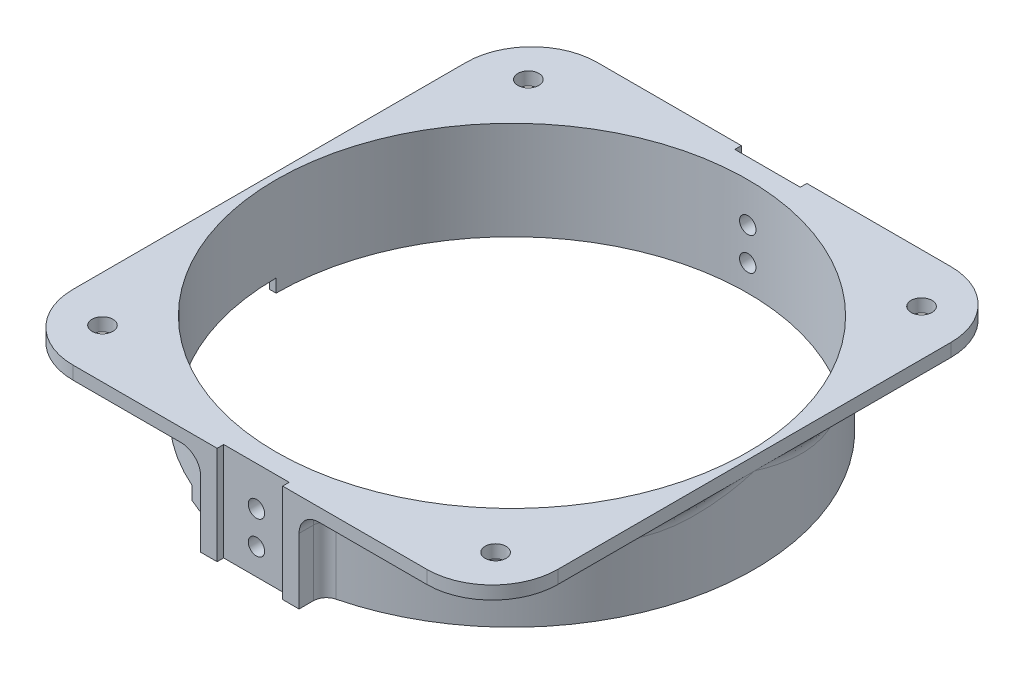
SolidWorks part; units mm, degrees
ref_plane "前视基准面" through (0, 0, 0) normal (0, 0, 1) x (1, 0, 0)
ref_plane "上视基准面" through (0, 0, 0) normal (0, 1, 0) x (1, 0, 0)
ref_plane "右视基准面" through (0, 0, 0) normal (1, 0, 0) x (0, 0, -1)
sketch "草图1" plane through (0, 0, 0) normal (0, 1, 0) x (1, 0, 0)
  circle A0 centre (0, 0) radius 36
  circle A1 centre (0, 0) radius 37
  dimension "D1" = 72
  dimension "D2" = 74
extrude "凸台-拉伸1" add sketch "草图1" along normal blind 15
sketch "草图2" plane through (0, 0, 0) normal (0, 1, 0) x (1, 0, 0)
  line L0 (-74.8137, 0) -> (0, 0) construction
  line L1 (0, 0) -> (0, -90.7206) construction
  line L3 (-37, 0) -> (-15, 0)
  line L4 (-37, 0) -> (-37, -40.3453)
  line L5 (-37, -40.3453) -> (-15, -40.3453)
  line L6 (-15, 0) -> (-15, -40.3453)
  circle A0 centre (0, 0) radius 37 construction
  dimension "D1" = 22
extrude "切除-拉伸1" cut sketch "草图2" along normal blind 2
sketch "草图3" plane through (0, 15, 0) normal (0, 1, 0) x (1, 0, 0)
  line L0 (0, -75.1314) -> (0, 57.0329) construction
  line L1 (57.2671, 0) -> (-67.0606, 0) construction
  line L2 (7.5, 40) -> (-7.5, 36.2319) construction
  line L3 (7.5, -40) -> (-7.5, -40)
  line L4 (7.5, -40) -> (7.5, -36.2319)
  line L5 (7.5, -36.2319) -> (-7.5, -36.2319)
  line L6 (-7.5, -40) -> (-7.5, -36.2319)
  line L7 (7.5, -40) -> (-7.5, -36.2319) construction
  line L8 (7.5, -36.2319) -> (-7.5, -40) construction
  line L9 (7.5, 40) -> (7.5, 36.2319)
  line L10 (7.5, 40) -> (-7.5, 40)
  line L11 (7.5, 36.2319) -> (-7.5, 40) construction
  line L12 (-7.5, 40) -> (-7.5, 36.2319)
  line L13 (7.5, 36.2319) -> (-7.5, 36.2319)
  circle A0 centre (0, 0) radius 37 construction
  point P5 (0, -38.1159)
  point P17 (0, 38.1159)
  dimension "D1" = 80
  dimension "D2" = 15
extrude "凸台-拉伸2" add sketch "草图3" against normal up to surface (15 mm away)
sketch "草图4" plane through (0, 15, 0) normal (0, 1, 0) x (1, 0, 0)
  line L0 (0, -71.6557) -> (0, 76.2439) construction
  line L1 (77.9233, 0) -> (-76.0365, 0) construction
  line L2 (7.5, 40) -> (-7.5, 40) construction
  line L3 (5, 39) -> (-5, 39)
  line L4 (5, 39) -> (5, 40)
  line L5 (5, 40) -> (-5, 40)
  line L6 (-5, 39) -> (-5, 40)
  line L7 (5, 39) -> (-5, 40) construction
  line L8 (5, 40) -> (-5, 39) construction
  line L9 (5, -40) -> (-5, -39) construction
  line L10 (5, -39) -> (-5, -40) construction
  line L11 (-5, -39) -> (-5, -40)
  line L12 (5, -40) -> (-5, -40)
  line L13 (5, -39) -> (5, -40)
  line L14 (5, -39) -> (-5, -39)
  point P5 (0, 39.5)
  point P16 (0, -39.5)
  dimension "D1" = 1
  dimension "D2" = 10
extrude "切除-拉伸2" cut sketch "草图4" against normal through all
fillet "圆角1" radius 2 4 edges at (-7.5, 7.5, 36.2319) (7.5, 7.5, 36.2319) (-7.5, 7.5, -36.2319) (7.5, 7.5, -36.2319)
sketch "草图5" plane through (0, 0, -39) normal (0, 0, -1) x (-1, 0, 0)
  line L0 (0, 22.5027) -> (0, -7.2445) construction
  line L1 (5, 0) -> (-5, 0) construction
  circle A0 centre (0, 4) radius 1.25
  circle A1 centre (0, 9) radius 1.25
  dimension "D1" = 2.5
  dimension "D2" = 4
  dimension "D3" = 5
extrude "切除-拉伸3" cut sketch "草图5" against normal through all
ref_plane "基准面1" through (0, 15, 0) normal (0, 1, 0) x (1, 0, 0)
sketch "草图6" plane through (0, 15, 0) normal (0, 1, 0) x (1, 0, 0)
  line L0 (-5, 40) -> (-7.5, 40) construction
  line L1 (37, -40) -> (-37, -40)
  line L2 (37, -40) -> (37, 40)
  line L3 (37, 40) -> (-37, 40)
  line L4 (-37, -40) -> (-37, 40)
  line L5 (37, -40) -> (-37, 40) construction
  line L6 (37, 40) -> (-37, -40) construction
  line L17 (-5, 39) -> (-5, 40)
  line L18 (-5, 39) -> (-5, 40)
  line L19 (-5, 40) -> (-7.5, 40)
  line L20 (-5, 40) -> (-7.5, 40)
  line L21 (5, -39) -> (5, -40)
  line L22 (5, -40) -> (7.5, -40)
  line L23 (7.5, -40) -> (7.5, -37.8253)
  line L24 (7.5, 37.8253) -> (7.5, 40)
  line L25 (7.5, 40) -> (5, 40)
  line L26 (5, 40) -> (5, 39)
  line L27 (5, 39) -> (-5, 39)
  line L28 (-7.5, 40) -> (-7.5, 37.8253)
  line L29 (-7.5, 40) -> (-7.5, 37.8253)
  line L34 (-7.5, -37.8253) -> (-7.5, -40)
  line L35 (5, -39) -> (5, -40)
  line L36 (5, -40) -> (7.5, -40)
  line L37 (7.5, -40) -> (7.5, -37.8253)
  line L38 (7.5, 37.8253) -> (7.5, 40)
  line L39 (7.5, 40) -> (5, 40)
  line L40 (5, 40) -> (5, 39)
  line L41 (5, 39) -> (-5, 39)
  line L42 (-7.5, -37.8253) -> (-7.5, -40)
  line L43 (-7.5, -40) -> (-5, -40)
  line L44 (-7.5, -40) -> (-5, -40)
  line L45 (-5, -40) -> (-5, -39)
  line L46 (-5, -40) -> (-5, -39)
  line L47 (-5, -39) -> (5, -39)
  line L48 (-5, -39) -> (5, -39)
  arc A0 (-9.0128, 35.8855) -> (-9.0128, -35.8855) centre (0, 0) ccw construction
  arc A5 (-9.0128, 35.8855) -> (-7.5, 37.8253) centre (-9.5, 37.8253) ccw
  arc A6 (-9.0128, 35.8855) -> (-7.5, 37.8253) centre (-9.5, 37.8253) ccw
  arc A7 (9.0128, -35.8855) -> (7.5, -37.8253) centre (9.5, -37.8253) ccw
  arc A8 (9.0128, -35.8855) -> (9.0128, 35.8855) centre (0, 0) ccw
  arc A9 (7.5, 37.8253) -> (9.0128, 35.8855) centre (9.5, 37.8253) ccw
  arc A12 (-9.0128, 35.8855) -> (-9.0128, -35.8855) centre (0, 0) ccw
  arc A13 (9.0128, -35.8855) -> (7.5, -37.8253) centre (9.5, -37.8253) ccw
  arc A14 (9.0128, -35.8855) -> (9.0128, 35.8855) centre (0, 0) ccw
  arc A15 (7.5, 37.8253) -> (9.0128, 35.8855) centre (9.5, 37.8253) ccw
  arc A16 (-9.0128, 35.8855) -> (-9.0128, -35.8855) centre (0, 0) ccw
  arc A17 (-7.5, -37.8253) -> (-9.0128, -35.8855) centre (-9.5, -37.8253) ccw
  arc A18 (-7.5, -37.8253) -> (-9.0128, -35.8855) centre (-9.5, -37.8253) ccw
  point P0 (0, 0)
  dimension "D1" = 0
extrude "凸台-拉伸3" add sketch "草图6" against normal blind 2 contours L4 L3 M37 M36 M35 | L2 L3 M29 M28 M27 | L1 L2 M27 M26 M25 | L4 L1 M39 M38 M37
fillet "圆角2" radius 10 4 edges at (-37, 14, 40) (37, 14, 40) (37, 14, -40) (-37, 14, -40)
sketch "草图7" plane through (0, 15, 0) normal (0, 1, 0) x (1, 0, 0)
  line L0 (0, 64.1626) -> (0, -66.2253) construction
  line L1 (-55.2969, 0) -> (65.2681, 0) construction
  circle A0 centre (-30, 32.5) radius 1.6
  circle A1 centre (30, 32.5) radius 1.6
  circle A2 centre (30, -32.5) radius 1.6
  circle A3 centre (-30, -32.5) radius 1.6
  dimension "D1" = 3.2
  dimension "D2" = 60
  dimension "D3" = 65
extrude "切除-拉伸4" cut sketch "草图7" against normal through all
fillet "圆角3" radius 3 12 edges at (-7.5, 13, -38.9126) (-7.9229, 13, -36.5953) (-29.176, 13, -22.7544) (-7.5, 13, 38.9126) (-7.9229, 13, 36.5953) (7.5, 13, 38.9126) (7.9229, 13, 36.5953) (7.5, 13, -38.9126) (7.9229, 13, -36.5953) (29.176, 13, -22.7544) (-29.176, 13, 22.7544) (29.176, 13, 22.7544)
